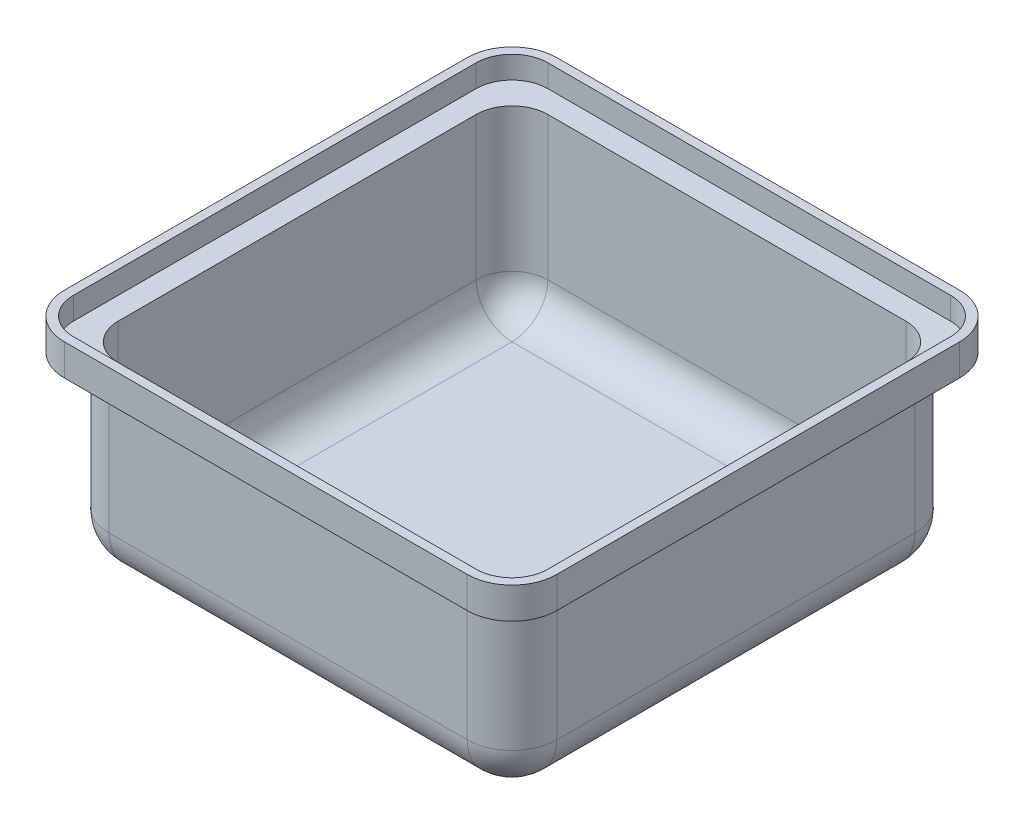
SolidWorks part; units mm, degrees
ref_plane "Front Plane" through (0, 0, 0) normal (0, 0, 1) x (1, 0, 0)
ref_plane "Top Plane" through (0, 0, 0) normal (0, 1, 0) x (1, 0, 0)
ref_plane "Right Plane" through (0, 0, 0) normal (1, 0, 0) x (0, 0, -1)
sketch "Sketch1" plane through (0, 0, 0) normal (0, 1, 0) x (1, 0, 0)
  line L0 (-63.5, -63.5) -> (63.5, 63.5) construction
  line L1 (-63.5, 63.5) -> (63.5, 63.5)
  line L2 (-63.5, 63.5) -> (-63.5, -63.5)
  line L3 (-63.5, -63.5) -> (63.5, -63.5)
  line L4 (63.5, 63.5) -> (63.5, -63.5)
  dimension "D1" = 127
  dimension "D2" = 127
extrude "Extrude1" add sketch "Sketch1" along normal blind 50.8
sketch "Sketch2" plane through (0, 50.8, 0) normal (0, 1, 0) x (-1, 0, 0)
  line L0 (69.85, -69.85) -> (-69.85, 69.85) construction
  line L1 (-69.85, -69.85) -> (69.85, -69.85)
  line L2 (-69.85, -69.85) -> (-69.85, 69.85)
  line L3 (-69.85, 69.85) -> (69.85, 69.85)
  line L4 (69.85, -69.85) -> (69.85, 69.85)
  dimension "D1" = 139.7
extrude "Extrude2" add sketch "Sketch2" along normal blind 8.89
fillet "Fillet1" radius 12.7 12 edges at (69.85, 55.245, 69.85) (69.85, 55.245, -69.85) (-69.85, 55.245, -69.85) (-69.85, 55.245, 69.85) (0, 0, -63.5) (63.5, 0, 0) (0, 0, 63.5) (-63.5, 0, 0) (-63.5, 25.4, -63.5) (63.5, 25.4, -63.5) (63.5, 25.4, 63.5) (-63.5, 25.4, 63.5)
shell "Shell1" thickness 2.54
